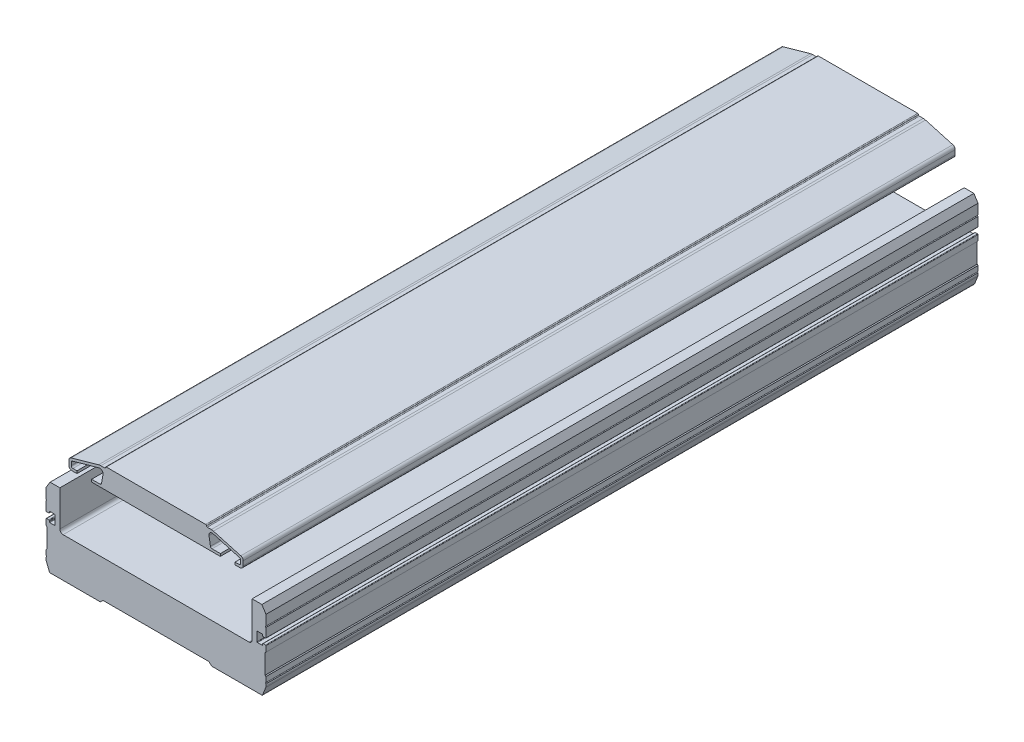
SolidWorks part; units mm, degrees
ref_plane "前视基准面" through (0, 0, 0) normal (0, 0, 1) x (1, 0, 0)
ref_plane "上视基准面" through (0, 0, 0) normal (0, 1, 0) x (1, 0, 0)
ref_plane "右视基准面" through (0, 0, 0) normal (1, 0, 0) x (0, 0, -1)
sketch "草图1" plane through (0, 0, 0) normal (0, 0, 1) x (1, 0, 0)
  line B0 (-39.5, 59.4) -> (39.5, 59.4)
  line B1 (39.5, 59.4) -> (39.5, 60.9)
  line B2 (39.5, 60.9) -> (34.4, 60.9)
  line B3 (33.4138, 61.7343) -> (32.5361, 66.9593)
  line B4 (35.0485, 69.2164) -> (51.27, 64.6675)
  line B5 (52, 63.7046) -> (52, 61.9)
  line B6 (51, 60.9) -> (48.5, 60.9)
  line B7 (48.5, 60.9) -> (48.5, 59.4)
  line B8 (48.5, 59.4) -> (51.5, 59.4)
  line B9 (53.5, 61.4) -> (53.5, 64.0837)
  line B10 (52.04, 66.0094) -> (35.2622, 70.7143)
  line B11 (33.9122, 70.9) -> (31.5, 70.9)
  line B12 (30.5, 71.9) -> (-30.5, 71.9)
  line B13 (-31.5, 70.9) -> (-33.9122, 70.9)
  line B14 (-35.2622, 70.7143) -> (-52.04, 66.0094)
  line B15 (-53.5, 64.0837) -> (-53.5, 61.4)
  line B16 (-51.5, 59.4) -> (-48.5, 59.4)
  line B17 (-48.5, 59.4) -> (-48.5, 60.9)
  line B18 (-48.5, 60.9) -> (-51, 60.9)
  line B19 (-52, 61.9) -> (-52, 63.7046)
  line B20 (-51.27, 64.6675) -> (-35.0485, 69.2164)
  line B21 (-32.5361, 66.9593) -> (-33.4138, 61.7343)
  line B22 (-34.4, 60.9) -> (-39.5, 60.9)
  line B23 (-39.5, 60.9) -> (-39.5, 59.4)
  line B24 (-67, 22) -> (-67, 10)
  line B25 (-67, 10) -> (-67.5, 9.5)
  line B26 (-67.5, 9.5) -> (-67.5, 6.375)
  line B27 (-67.5, 5.625) -> (-67.5, 4.3812)
  line B28 (-67.36, 3.6469) -> (-65.5064, -1.0289)
  line B29 (-65.16, -1.6) -> (-34.1, -1.6)
  line B30 (-34.1, -1.6) -> (-32.5, 0)
  line B31 (-32.5, 0) -> (32.5, 0)
  line B32 (32.5, 0) -> (34.1, -1.6)
  line B33 (34.1, -1.6) -> (65.16, -1.6)
  line B34 (65.5064, -1.0289) -> (67.36, 3.6469)
  line B35 (67.5, 4.3812) -> (67.5, 5.625)
  line B36 (67.5, 6.375) -> (67.5, 9.5)
  line B37 (67.5, 9.5) -> (67, 10)
  line B38 (67, 10) -> (67, 22)
  line B39 (67, 22) -> (67.5, 22.5)
  line B40 (67.5, 22.5) -> (67.5, 25.9)
  line B41 (67.2, 26.2) -> (65.8, 26.2)
  line B42 (65.5, 25.9) -> (65.5, 25.3)
  line B43 (65.2, 25) -> (62.3, 25)
  line B44 (62, 25.3) -> (62, 30.7)
  line B45 (62.3, 31) -> (65.2, 31)
  line B46 (65.5, 30.7) -> (65.5, 30.1)
  line B47 (65.8, 29.8) -> (67.2, 29.8)
  line B48 (67.5, 30.1) -> (67.5, 35.625)
  line B49 (67.5, 36.375) -> (67.5, 42.6)
  line B50 (67.5, 42.6) -> (65, 46.6)
  line B51 (65, 46.6) -> (59, 46.6)
  line B52 (59, 46.6) -> (59, 24.7)
  line B53 (57, 22.7) -> (-57, 22.7)
  line B54 (-59, 24.7) -> (-59, 46.6)
  line B55 (-59, 46.6) -> (-65, 46.6)
  line B56 (-65, 46.6) -> (-67.5, 42.6)
  line B57 (-67.5, 42.6) -> (-67.5, 36.375)
  line B58 (-67.5, 35.625) -> (-67.5, 30.1)
  line B59 (-67.2, 29.8) -> (-65.8, 29.8)
  line B60 (-65.5, 30.1) -> (-65.5, 30.7)
  line B61 (-65.2, 31) -> (-62.3, 31)
  line B62 (-62, 30.7) -> (-62, 25.3)
  line B63 (-62.3, 25) -> (-65.2, 25)
  line B64 (-65.5, 25.3) -> (-65.5, 25.9)
  line B65 (-65.8, 26.2) -> (-67.2, 26.2)
  line B66 (-67.5, 25.9) -> (-67.5, 22.5)
  line B67 (-67.5, 22.5) -> (-67, 22)
  arc B68 (33.4138, 61.7343) -> (34.4, 60.9) centre (34.4, 61.9) ccw
  arc B69 (35.0485, 69.2164) -> (32.5361, 66.9593) centre (34.5085, 67.2906) ccw
  arc B70 (52, 63.7046) -> (51.27, 64.6675) centre (51, 63.7046) ccw
  arc B71 (51, 60.9) -> (52, 61.9) centre (51, 61.9) ccw
  arc B72 (51.5, 59.4) -> (53.5, 61.4) centre (51.5, 61.4) ccw
  arc B73 (53.5, 64.0837) -> (52.04, 66.0094) centre (51.5, 64.0837) ccw
  arc B74 (35.2622, 70.7143) -> (33.9122, 70.9) centre (33.9122, 65.9) ccw
  arc B75 (31, 71.4) -> (31.5, 70.9) centre (31.5, 71.4) ccw
  arc B76 (31, 71.4) -> (30.5, 71.9) centre (30.5, 71.4) ccw
  arc B77 (-30.5, 71.9) -> (-31, 71.4) centre (-30.5, 71.4) ccw
  arc B78 (-31.5, 70.9) -> (-31, 71.4) centre (-31.5, 71.4) ccw
  arc B79 (-33.9122, 70.9) -> (-35.2622, 70.7143) centre (-33.9122, 65.9) ccw
  arc B80 (-52.04, 66.0094) -> (-53.5, 64.0837) centre (-51.5, 64.0837) ccw
  arc B81 (-53.5, 61.4) -> (-51.5, 59.4) centre (-51.5, 61.4) ccw
  arc B82 (-52, 61.9) -> (-51, 60.9) centre (-51, 61.9) ccw
  arc B83 (-51.27, 64.6675) -> (-52, 63.7046) centre (-51, 63.7046) ccw
  arc B84 (-32.5361, 66.9593) -> (-35.0485, 69.2164) centre (-34.5085, 67.2906) ccw
  arc B85 (-34.4, 60.9) -> (-33.4138, 61.7343) centre (-34.4, 61.9) ccw
  arc B86 (-67.5, 5.625) -> (-67.5, 6.375) centre (-67.5, 6) ccw
  arc B87 (-67.5, 4.3812) -> (-67.36, 3.6469) centre (-65.5, 4.382) ccw
  arc B88 (-65.5064, -1.0289) -> (-65.16, -1.6) centre (-63.6472, -0.2918) ccw
  arc B89 (65.16, -1.6) -> (65.5064, -1.0289) centre (63.6472, -0.2918) ccw
  arc B90 (67.36, 3.6469) -> (67.5, 4.3812) centre (65.5, 4.382) ccw
  arc B91 (67.5, 6.375) -> (67.5, 5.625) centre (67.5, 6) ccw
  arc B92 (67.5, 25.9) -> (67.2, 26.2) centre (67.2, 25.9) ccw
  arc B93 (65.8, 26.2) -> (65.5, 25.9) centre (65.8, 25.9) ccw
  arc B94 (65.2, 25) -> (65.5, 25.3) centre (65.2, 25.3) ccw
  arc B95 (62, 25.3) -> (62.3, 25) centre (62.3, 25.3) ccw
  arc B96 (62.3, 31) -> (62, 30.7) centre (62.3, 30.7) ccw
  arc B97 (65.5, 30.7) -> (65.2, 31) centre (65.2, 30.7) ccw
  arc B98 (65.5, 30.1) -> (65.8, 29.8) centre (65.8, 30.1) ccw
  arc B99 (67.2, 29.8) -> (67.5, 30.1) centre (67.2, 30.1) ccw
  arc B100 (67.5, 36.375) -> (67.5, 35.625) centre (67.5, 36) ccw
  arc B101 (57, 22.7) -> (59, 24.7) centre (57, 24.7) ccw
  arc B102 (-59, 24.7) -> (-57, 22.7) centre (-57, 24.7) ccw
  arc B103 (-67.5, 35.625) -> (-67.5, 36.375) centre (-67.5, 36) ccw
  arc B104 (-67.5, 30.1) -> (-67.2, 29.8) centre (-67.2, 30.1) ccw
  arc B105 (-65.8, 29.8) -> (-65.5, 30.1) centre (-65.8, 30.1) ccw
  arc B106 (-65.2, 31) -> (-65.5, 30.7) centre (-65.2, 30.7) ccw
  arc B107 (-62, 30.7) -> (-62.3, 31) centre (-62.3, 30.7) ccw
  arc B108 (-62.3, 25) -> (-62, 25.3) centre (-62.3, 25.3) ccw
  arc B109 (-65.5, 25.3) -> (-65.2, 25) centre (-65.2, 25.3) ccw
  arc B110 (-65.5, 25.9) -> (-65.8, 26.2) centre (-65.8, 25.9) ccw
  arc B111 (-67.2, 26.2) -> (-67.5, 25.9) centre (-67.2, 25.9) ccw
sketch_block_instance "块4-1"
sketch_block "块4"
extrude "凸台-拉伸1" add sketch "草图1" against normal blind 437
hole_wizard "打孔尺寸(%根据)内六角圆柱头螺钉的类型1" positions "草图3" profile "草图4" counterbore size "M6" standard "GB"
sketch "草图3" plane through (0, 46.6, 0) normal (0, 1, 0) x (1, 0, 0)
  line L4 (34.1, 437) -> (65.16, 437) construction
  line L5 (0, 437) -> (0, 1140.2602) construction
  line L6 (-32.5, 437) -> (32.5, 437) construction
  point P0 (-53, 365.5)
  point P2 (53, 365.5)
  point P13 (53, 265.5)
  point P15 (-53, 265.5)
  point P22 (53, 65.5)
  point P24 (-53, 65.5)
  point P25 (53, -134.5)
  point P27 (-53, -134.5)
  point P29 (53, -334.5)
  point P31 (-53, -334.5)
  point P33 (53, -534.5)
  point P35 (-53, -534.5)
  point P45 (-53, -734.5)
  point P47 (53, -734.5)
  dimension "D1" = 106
  dimension "D2" = 200
  dimension "D3" = 71.5
  dimension "D4" = 100
  dimension "D5" = 200
  dimension "D6" = 200
  dimension "D7" = 200
  dimension "D8" = 200
sketch "草图4" plane through (-53, 46.6, -365.5) normal (1, 0, 0) x (0, 0, 1)
  line L0 (0, 0) -> (0, 48.2)
  line L1 (0, 48.2) -> (3.5, 48.2)
  line L3 (3.5, 48.2) -> (3.5, 41)
  line L4 (3.5, 41) -> (5.5, 41)
  line L5 (5.5, 41) -> (5.5, 0)
  line L7 (5.5, 0) -> (0, 0)
  line L11 (0, -6.35) -> (0, 107.95) construction
  dimension "通孔孔直径" = 7
  dimension "通孔孔深度" = 48.2
  dimension "柱形沉头孔直径" = 11
  dimension "柱形沉头孔深度" = 41
hole_wizard "M6 螺纹孔0" positions "草图5" profile "草图6" tap size "M6" standard "GB"
sketch "草图5" plane through (0, -1.6, 0) normal (0, -1, 0) x (-1, 0, 0)
  line L0 (53, 365.5) -> (53, 375.5) construction
  line L1 (-53, 365.5) -> (-53, 375.5) construction
  line L4 (65.16, 437) -> (34.1, 437) construction
  point P0 (53, 375.5)
  point P2 (-53, 375.5)
  point P12 (53, 275.5)
  point P14 (-53, 275.5)
  point P19 (-53, 75.5)
  point P21 (53, 75.5)
  point P23 (-53, -124.5)
  point P25 (53, -124.5)
  point P27 (-53, -324.5)
  point P29 (53, -324.5)
  point P31 (-53, -524.5)
  point P33 (53, -524.5)
  point P36 (53, -724.5)
  point P38 (-53, -724.5)
  dimension "D1" = 61.5
  dimension "D2" = 100
  dimension "D3" = 200
  dimension "D4" = 200
  dimension "D5" = 200
  dimension "D6" = 200
  dimension "D7" = 200
sketch "草图6" plane through (-53, -1.6, -375.5) normal (1, 0, 0) x (0, 0, -1)
  line L0 (0, 0) -> (0, 16.5022)
  line L1 (0, 16.5022) -> (2.5, 15)
  line L2 (2.5, 15) -> (2.5, 0)
  line L5 (2.5, 0) -> (0, 0)
  line L10 (0, 16.5022) -> (-2.5, 15) construction
  line L11 (0, -6.35) -> (0, 107.95) construction
  dimension "螺纹孔钻头直径" = 5
  dimension "螺纹孔钻头深度" = 15
  dimension "导头角度" = 118
